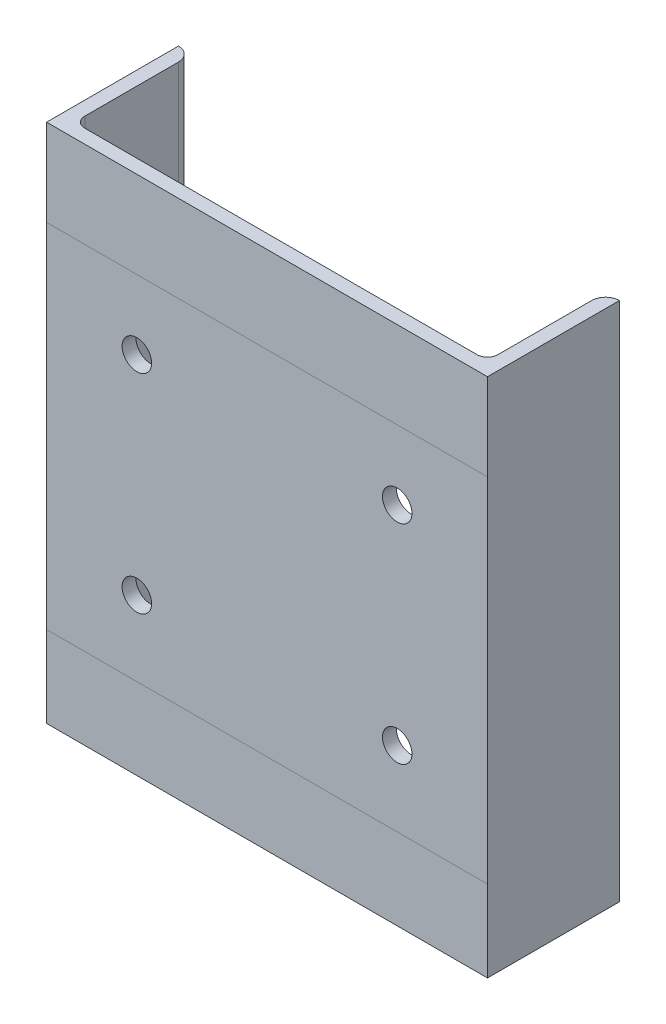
SolidWorks part; units mm, degrees
ref_plane "Front Plane" through (0, 0, 0) normal (0, 0, 1) x (1, 0, 0)
ref_plane "Top Plane" through (0, 0, 0) normal (0, 1, 0) x (1, 0, 0)
ref_plane "Right Plane" through (0, 0, 0) normal (1, 0, 0) x (0, 0, -1)
sketch "Sketch1" plane through (0, 0, 0) normal (0, 1, 0) x (1, 0, 0)
  line L0 (-127, 0) -> (127, 0)
  line L1 (-127, 0) -> (-127, 76)
  line L2 (127, 0) -> (127, 76)
  line L3 (-113, 8) -> (113, 8)
  line L4 (119, 14) -> (119, 68)
  line L5 (-119, 14) -> (-119, 68)
  arc A0 (113, 8) -> (119, 14) centre (113, 14) ccw
  arc A1 (-113, 8) -> (-119, 14) centre (-113, 14) cw
  arc A2 (119, 68) -> (127, 76) centre (127, 68) cw
  arc A3 (-119, 68) -> (-127, 76) centre (-127, 68) ccw
  point P11 (119, 8)
  point P14 (-119, 8)
  dimension "D6" = 6
  dimension "D7" = 6
  dimension "D1" = 254
  dimension "D2" = 238
  dimension "D3" = 60
  dimension "D4" = 76
  dimension "D5" = 8
  dimension "D8" = 127
  dimension "D9" = 119
extrude "Extrude1" add sketch "Sketch1" along normal mid plane 300
sketch "Sketch2" plane through (0, 0, 0) normal (0, 0, 1) x (1, 0, 0)
  line L0 (127, 150) -> (127, -150) construction
  circle A0 centre (75, 60) radius 8.5
  circle A1 centre (-75, 60) radius 8.5
  circle A2 centre (-75, -60) radius 8.5
  circle A3 centre (75, -60) radius 8.5
  dimension "D1" = 17
  dimension "D2" = 60
  dimension "D3" = 60
  dimension "D4" = 60
  dimension "D5" = 60
  dimension "D6" = 52
  dimension "D7" = 52
  dimension "D8" = 150
  dimension "D9" = 150
extrude "Cut-Extrude1" cut sketch "Sketch2" against normal up to next
ref_plane "Plane1" through (0, 0, 10) normal (0, 0, 1) x (1, 0, 0)
sketch "Sketch3" plane through (0, 0, 10) normal (0, 0, 1) x (1, 0, 0)
  line L1 (127, 100) -> (-127, 100)
  line L2 (127, 100) -> (127, -103.1264)
  line L3 (127, -103.1264) -> (-127, -103.1264)
  line L4 (-127, 100) -> (-127, -103.1264)
  dimension "D1" = 254
  dimension "D2" = 127
  dimension "D3" = 100
